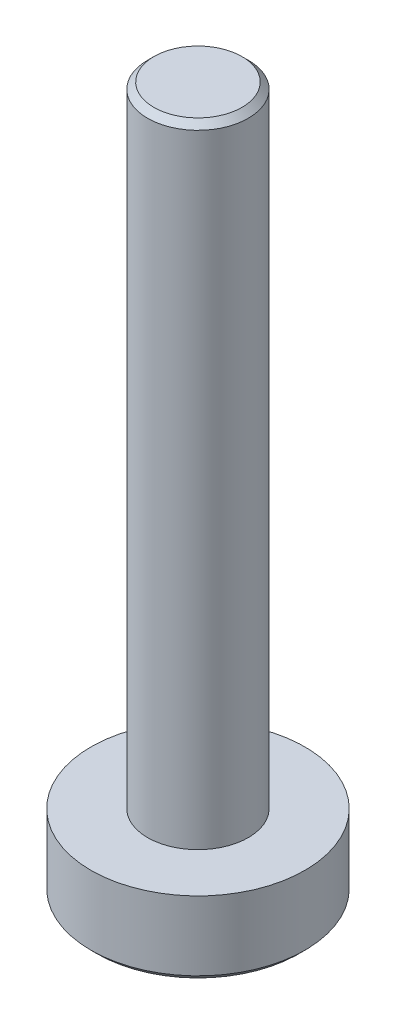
SolidWorks part; units mm, degrees
ref_plane "Face" through (0, 0, 0) normal (0, 0, 1) x (1, 0, 0)
ref_plane "Dessus" through (0, 0, 0) normal (0, 1, 0) x (1, 0, 0)
ref_plane "Droite" through (0, 0, 0) normal (1, 0, 0) x (0, 0, -1)
sketch "Esquisse1" plane through (0, 0, 0) normal (0, 1, 0) x (1, 0, 0)
  circle A0 centre (0, 0) radius 8.5
  dimension "D1" = 17
extrude "Extrusion1" add sketch "Esquisse1" against normal blind 6
sketch "Esquisse2" plane through (0, 0, 0) normal (0, 1, 0) x (-1, 0, 0)
  circle A0 centre (0, 0) radius 4
  circle A1 centre (0, 0) radius 8.5 construction
  dimension "D1" = 8
extrude "Extrusion2" add sketch "Esquisse2" along normal blind 50
chamfer "Chanfrein1" distance 0.5 angle 45
chamfer "Chanfrein2" distance 0.5 angle 45
